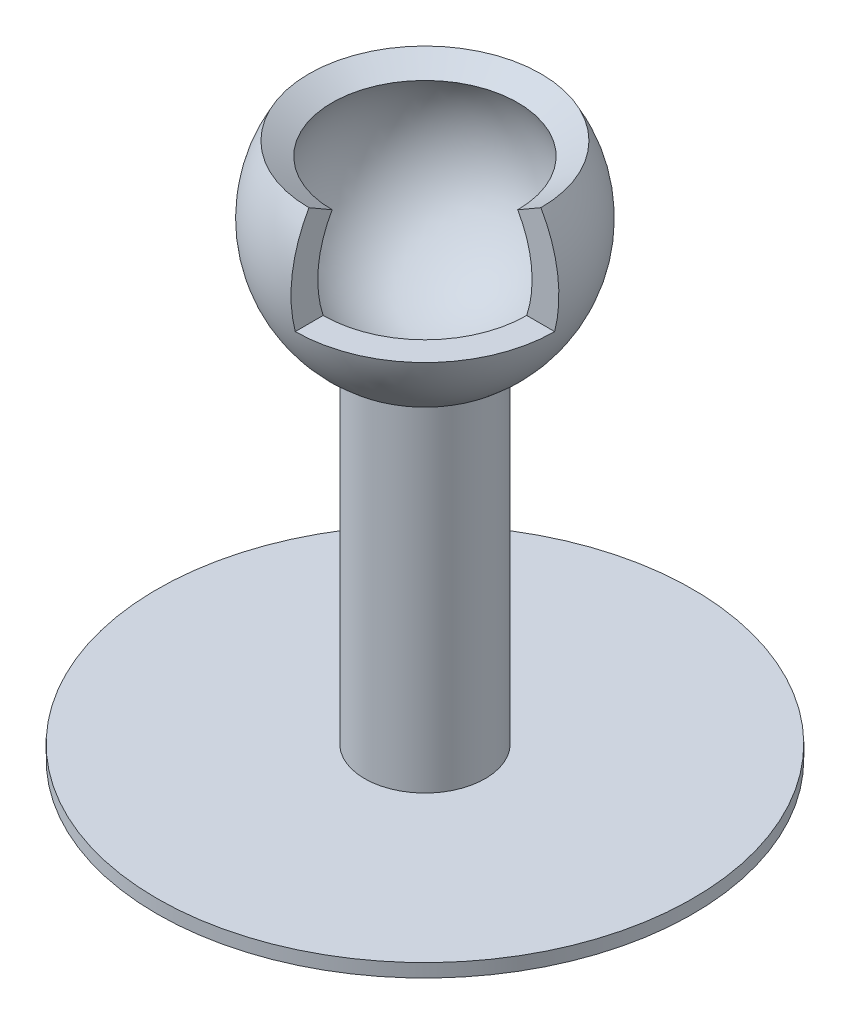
SolidWorks part; units mm, degrees
ref_plane "Plan de face" through (0, 0, 0) normal (0, 0, 1) x (1, 0, 0)
ref_plane "Plan de dessus" through (0, 0, 0) normal (0, 1, 0) x (1, 0, 0)
ref_plane "Plan de droite" through (0, 0, 0) normal (1, 0, 0) x (0, 0, -1)
sketch "Esquisse1" plane through (0, 0, 0) normal (0, 0, 1) x (1, 0, 0)
  line L0 (0, -16) -> (0, -20)
  line L1 (13.8564, 8) -> (17.3205, 10)
  line L2 (0, 21.4112) -> (0, -23.3838) construction
  arc A0 (0, -16) -> (13.8564, 8) centre (0, 0) ccw
  arc A1 (0, -20) -> (17.3205, 10) centre (0, 0) ccw
  dimension "D1" = 120
  dimension "D2" = 20
ref_plane "Plan1" through (0, -70, 0) normal (0, 1, 0) x (-1, 0, 0)
sketch "Esquisse2" plane through (0, -70, 0) normal (0, 1, 0) x (-1, 0, 0)
  circle A0 centre (0, 0) radius 40
extrude "Boss.-Extru.2" add sketch "Esquisse2" along normal blind 2 separate body
sketch "Esquisse3" plane through (0, -68, 0) normal (0, 1, 0) x (1, 0, 0)
  circle A0 centre (0, 0) radius 9
revolve "Révolution1" add sketch "Esquisse1" angle 360 about L2
extrude "Boss.-Extru.3" add sketch "Esquisse3" along normal up to surface (50.1394 mm away)
ref_plane "Plan2" through (0, 10, 0) normal (0, -1, 0) x (1, 0, 0)
sketch "Esquisse4" plane through (0, 10, 0) normal (0, -1, 0) x (1, 0, 0)
  line L1 (0, 0) -> (27.3948, 0)
  line L2 (0, 0) -> (0, 26.3098)
  line L3 (0, 26.3098) -> (27.3948, 26.3098)
  line L4 (27.3948, 0) -> (27.3948, 26.3098)
extrude "Enlèv. mat.-Extru.1" cut sketch "Esquisse4" along normal blind 15
